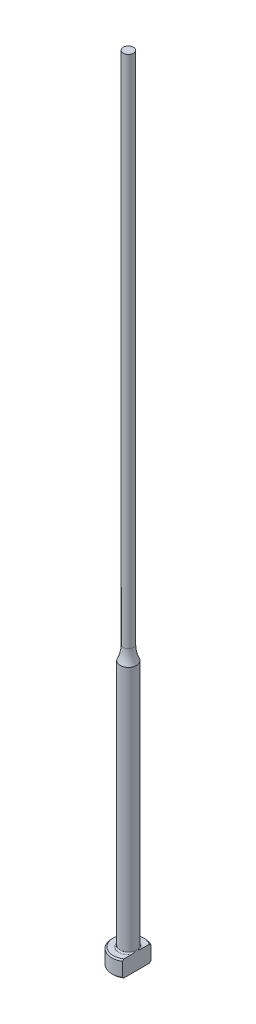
SolidWorks part; units mm, degrees
ref_plane "Front Plane" through (0, 0, 0) normal (0, 0, 1) x (1, 0, 0)
ref_plane "Top Plane" through (0, 0, 0) normal (0, 1, 0) x (1, 0, 0)
ref_plane "Right Plane" through (0, 0, 0) normal (1, 0, 0) x (0, 0, -1)
sketch "Sketch1" plane through (0, 0, 0) normal (0, 0, 1) x (1, 0, 0)
  line L0 (0, 259.9588) -> (0, -15.1925) construction
  line L1 (0, 0) -> (-3.175, 0)
  line L2 (-3.175, 0) -> (-3.175, 3.175)
  line L3 (-3.175, 3.175) -> (-1.5875, 3.175)
  line L4 (-0.9919, 53.4851) -> (-0.9919, 152.4)
  line L5 (-0.9919, 152.4) -> (0, 152.4)
  line L6 (0, 152.4) -> (0, 0)
  line L7 (-1.5875, 3.175) -> (-1.5875, 50.8)
  arc A0 (-1.5875, 50.8) -> (-0.9919, 53.4851) centre (-7.3419, 53.4851) ccw
  point P13 (-1.5875, 0)
  dimension "D1" = 6.35
  dimension "L" = 152.4
  dimension "D2" = 3.175
  dimension "H" = 6.35
  dimension "T" = 3.175
  dimension "D" = 1.9837
  dimension "S" = 50.8
revolve "Revolve1" add sketch "Sketch1" angle 360 about L0
chamfer "Chamfer1" distance 0.254 angle 45 2 edges at (0, 3.175, 3.175) (0, 0, 3.175)
fillet "Fillet1" radius 0.254 1 edges at (0, 3.175, 1.5875)
sketch "Sketch2" plane through (0, 0, 0) normal (0, 1, 0) x (1, 0, 0)
  line L0 (1.5875, -2.7496) -> (1.5875, 2.7496)
  circle A0 centre (0, 0) radius 3.175 construction
  arc A2 (1.5875, -2.7496) -> (1.5875, 2.7496) centre (0, 0) ccw
  circle A3 centre (0, 0) radius 3.175 construction
  circle A4 centre (0, 0) radius 1.5875 construction
extrude "Key Head" cut sketch "Sketch2" along normal up to next
